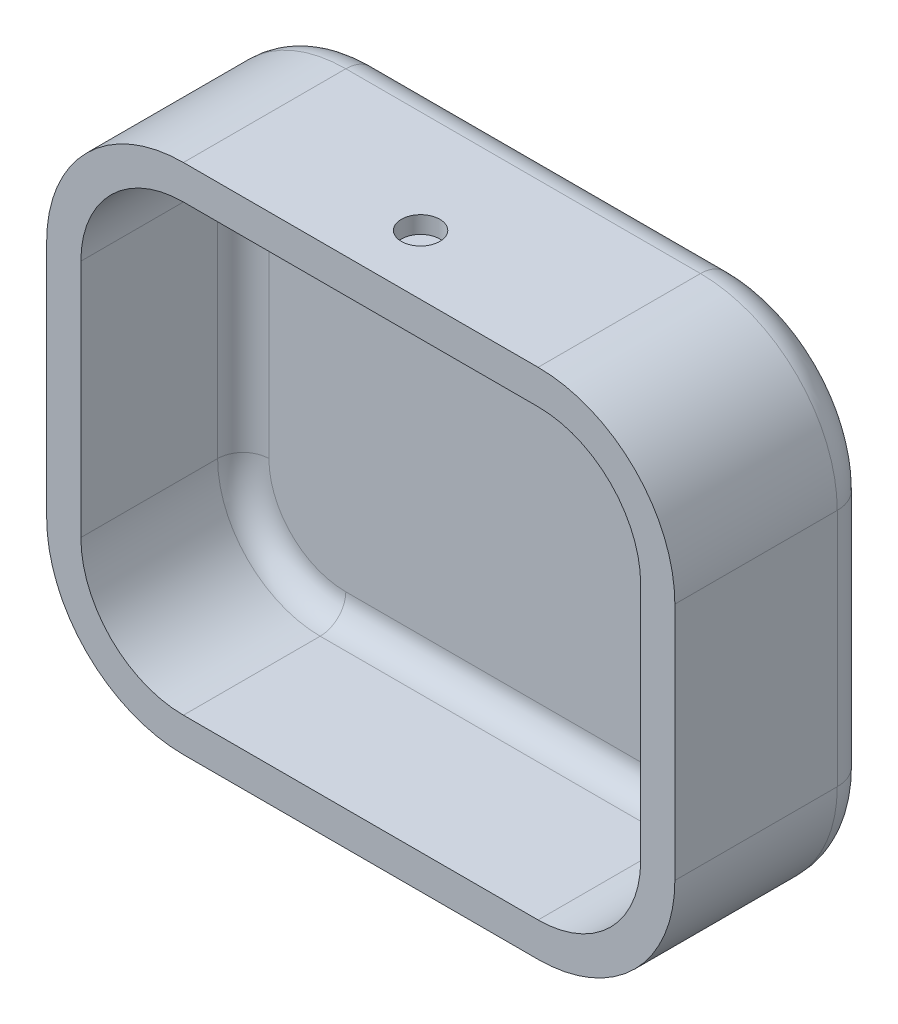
SolidWorks part; units mm, degrees
ref_plane "Plano frontal" through (0, 0, 0) normal (0, 0, 1) x (1, 0, 0)
ref_plane "Plano superior" through (0, 0, 0) normal (0, 1, 0) x (1, 0, 0)
ref_plane "Plano direito" through (0, 0, 0) normal (1, 0, 0) x (0, 0, -1)
sketch "Sketch1" plane through (0, 0, 0) normal (0, 0, 1) x (1, 0, 0)
  line L0 (0, 12) -> (0, 40)
  line L1 (12, 52) -> (53.5, 52)
  line L2 (65.5, 40) -> (65.5, 12)
  line L3 (53.5, 0) -> (12, 0)
  line L4 (-4, 12) -> (-4, 40)
  line L5 (53.5, -4) -> (12, -4)
  line L6 (69.5, 40) -> (69.5, 12)
  line L7 (12, 56) -> (53.5, 56)
  arc A0 (0, 12) -> (12, 0) centre (12, 12) ccw
  arc A1 (53.5, 0) -> (65.5, 12) centre (53.5, 12) ccw
  arc A2 (65.5, 40) -> (53.5, 52) centre (53.5, 40) ccw
  arc A3 (12, 52) -> (0, 40) centre (12, 40) ccw
  arc A4 (12, 56) -> (-4, 40) centre (12, 40) ccw
  arc A5 (-4, 12) -> (12, -4) centre (12, 12) ccw
  arc A6 (53.5, -4) -> (69.5, 12) centre (53.5, 12) ccw
  arc A7 (69.5, 40) -> (53.5, 56) centre (53.5, 40) ccw
  point P7 (0, 0)
  point P12 (65.5, 52)
  point P15 (0, 52)
  dimension "D3" = 12
  dimension "D1" = 52
  dimension "D2" = 65.5
  dimension "D4" = 4
extrude "Boss-Extrude1" add sketch "Sketch1" along normal blind 19
sketch "Sketch7" plane through (0, 0, 0) normal (0, 0, -1) x (-1, 0, 0)
  line L0 (-53.5, 56) -> (-12, 56)
  line L1 (-53.5, 56) -> (-12, 56) construction
  line L2 (-69.5, 40) -> (-69.5, 12)
  line L3 (-53.5, -4) -> (-12, -4)
  line L4 (4, 12) -> (4, 40)
  arc A0 (-53.5, 56) -> (-69.5, 40) centre (-53.5, 40) ccw
  arc A1 (-69.5, 12) -> (-53.5, -4) centre (-53.5, 12) ccw
  arc A2 (-12, -4) -> (4, 12) centre (-12, 12) ccw
  arc A3 (4, 40) -> (-12, 56) centre (-12, 40) ccw
extrude "Boss-Extrude2" add sketch "Sketch7" along normal blind 4
fillet "Fillet1" radius 4 8 edges at (0.6863, 51.3137, -4) (-4, 26, -4) (0.6863, 0.6863, -4) (32.75, -4, -4) (64.8137, 0.6863, -4) (69.5, 26, -4) (64.8137, 51.3137, -4) (32.75, 56, -4)
fillet "Fillet2" radius 3 8 edges at (65.5, 26, 0) (61.9853, 3.5147, 0) (32.75, 0, 0) (3.5147, 3.5147, 0) (0, 26, 0) (61.9853, 48.4853, 0) (32.75, 52, 0) (3.5147, 48.4853, 0)
sketch "Sketch9" plane through (0, 56, 0) normal (0, 1, 0) x (1, 0, 0)
  line L0 (32.75, -19) -> (32.75, -12) construction
  line L1 (53.5, -19) -> (12, -19) construction
  circle A0 centre (32.75, -12) radius 2.25
  dimension "D2" = 4.5
  dimension "D1" = 7
extrude "Cut-Extrude1" cut sketch "Sketch9" against normal blind 2
sketch "Sketch10" plane through (0, -4, 0) normal (0, -1, 0) x (1, 0, 0)
  line L0 (32.75, 19) -> (32.75, 12) construction
  line L1 (12, 19) -> (53.5, 19) construction
  circle A0 centre (32.75, 12) radius 2.25
  dimension "D2" = 4.5
  dimension "D1" = 7
extrude "Cut-Extrude2" cut sketch "Sketch10" against normal blind 2
